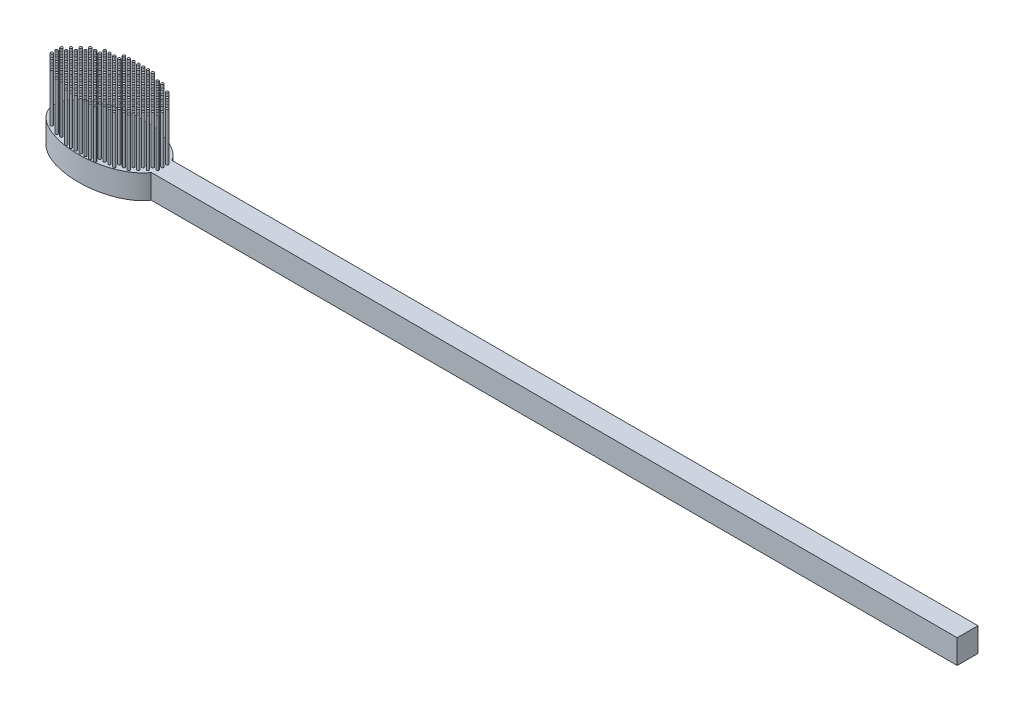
SolidWorks part; units mm, degrees
ref_plane "Front Plane" through (0, 0, 0) normal (0, 0, 1) x (1, 0, 0)
ref_plane "Top Plane" through (0, 0, 0) normal (0, 1, 0) x (1, 0, 0)
ref_plane "Right Plane" through (0, 0, 0) normal (1, 0, 0) x (0, 0, -1)
sketch "Sketch1" plane through (0, 0, 0) normal (0, 1, 0) x (1, 0, 0)
  line L0 (-11.5, 0) -> (11.5, 0) construction
  line L1 (11.5, 0) -> (178.5, 0) construction
  line L3 (10.8423, -2.1667) -> (178.5, -2.1667)
  line L5 (10.8423, 2.1667) -> (178.5, 2.1667)
  line L6 (178.5, -2.1667) -> (178.5, 2.1667)
  ellipse E0 centre (0, 0) end of major axis (11.5, 0) minor radius 6.5 (10.8423, 2.1667) -> (10.8423, -2.1667) ccw
extrude "Boss-Extrude1" add sketch "Sketch1" against normal blind 5
sketch "Sketch3" plane through (0, 0, 0) normal (0, 1, 0) x (1, 0, 0)
  circle A0 centre (0, 0) radius 0.25
  dimension "D1" = 0.5
extrude "Boss-Extrude2" add sketch "Sketch3" along normal blind 10
sketch "Sketch4" plane through (0, 0, 0) normal (0, 1, 0) x (1, 0, 0)
  line L0 (0, 0) -> (11.5, 0) construction
  line L1 (0, 0) -> (0, 6.5) construction
  ellipse E0 centre (0, 0) end of major axis (11.5, 0) minor radius 6.5 construction
pattern_linear "LPattern1" count 12 spacing 1 along (1, 0, 0) count 7 spacing 1 along (0, 0, 1) of "Boss-Extrude2"
mirror "Mirror1" about plane through (0, 0, 0) normal (0, 0, 1) of "LPattern1"
mirror "Mirror2" about plane through (0, 0, 0) normal (1, 0, 0) of "LPattern1", "Mirror1"
ref_plane "Positioning Block Plane" through (-11.5, 0, 0) normal (1, 0, 0) x (0, 0, -1)
equation "\"D4@Sketch1\"=\"D1@Sketch1\"/3"
